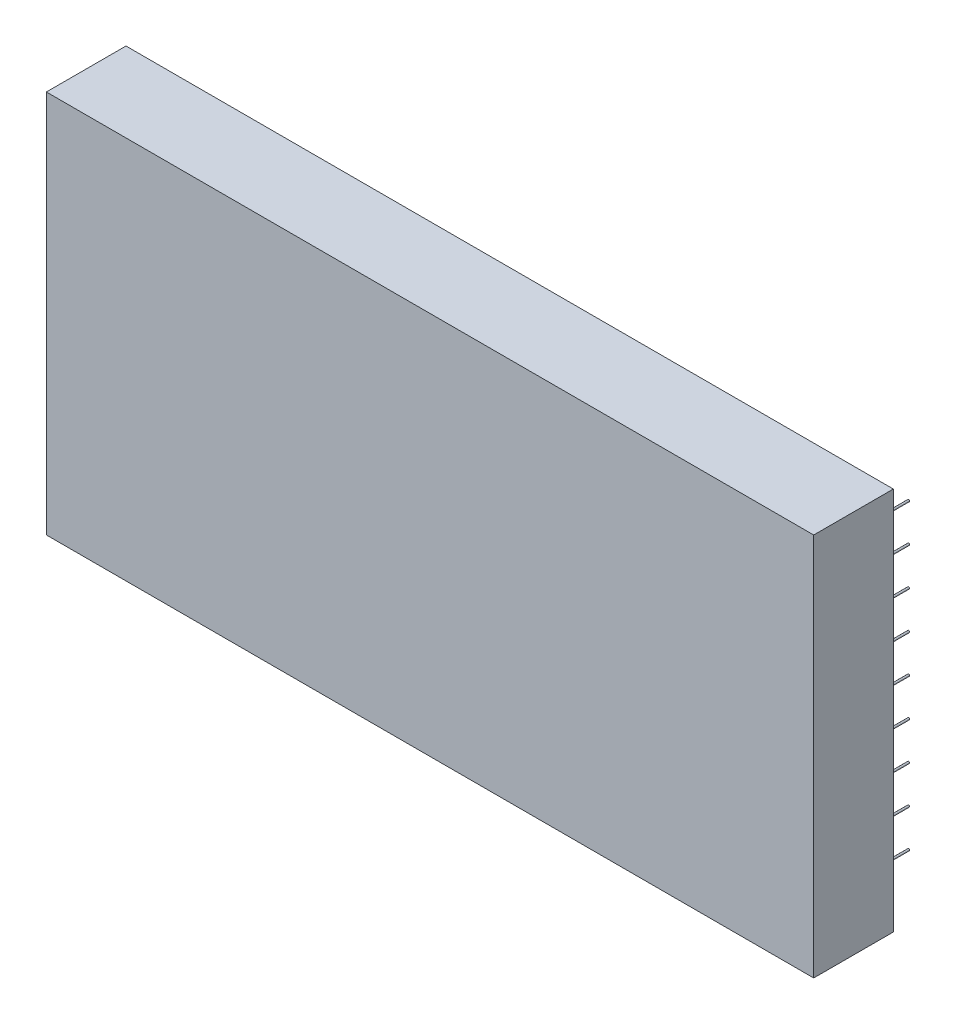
SolidWorks part; units mm, degrees
ref_plane "前视基准面" through (0, 0, 0) normal (0, 0, 1) x (1, 0, 0)
ref_plane "上视基准面" through (0, 0, 0) normal (0, 1, 0) x (1, 0, 0)
ref_plane "右视基准面" through (0, 0, 0) normal (1, 0, 0) x (0, 0, -1)
sketch "草图1" plane through (0, 0, 0) normal (0, 0, 1) x (1, 0, 0)
  line L1 (-2000, 1000) -> (2000, 1000)
  line L2 (-2000, 1000) -> (-2000, -1000)
  line L3 (-2000, -1000) -> (2000, -1000)
  line L4 (2000, 1000) -> (2000, -1000)
  line L5 (-2000, 1000) -> (2000, -1000) construction
  line L6 (-2000, -1000) -> (2000, 1000) construction
  point P0 (0, 0)
  dimension "D1" = 2000
  dimension "D2" = 4000
extrude "凸台-拉伸1" add sketch "草图1" along normal blind 415
sketch "草图2" plane through (0, -1000, 0) normal (0, 1, 0) x (1, 0, 0)
  line L0 (2000, 0) -> (-570, 0) construction
  line L1 (2000, 0) -> (-2000, 0) construction
  line L2 (-570, 0) -> (-570, -400) construction
  line L4 (-570, -400) -> (-370, -400)
  line L5 (-370, -400) -> (-370, -250)
  line L6 (-370, -250) -> (-270, -250)
  line L7 (-270, -250) -> (-270, 0)
  line L8 (-270, 0) -> (-970, 0)
  line L9 (-970, 0) -> (-970, -100)
  line L10 (-970, -100) -> (-870, -100)
  line L11 (-870, -100) -> (-870, -200)
  line L12 (-870, -200) -> (-770, -200)
  line L13 (-770, -200) -> (-770, -300)
  line L14 (-770, -300) -> (-670, -300)
  line L15 (-670, -300) -> (-670, -400)
  line L16 (-670, -400) -> (-570, -400)
  dimension "D1" = 2570
  dimension "D2" = 400
  dimension "D3" = 100
  dimension "D4" = 100
  dimension "D5" = 100
  dimension "D6" = 100
  dimension "D7" = 100
  dimension "D8" = 100
  dimension "D9" = 600
  dimension "D10" = 300
  dimension "D11" = 150
  dimension "D12" = 100
extrude "切除-拉伸1" cut sketch "草图2" along normal blind 515
sketch "草图4" plane through (0, 0, 0) normal (0, 0, -1) x (-1, 0, 0)
  line L0 (270, -485) -> (970, -485) construction
  line L1 (270, 835) -> (870, 835)
  line L2 (270, 835) -> (270, -485)
  line L3 (270, -485) -> (870, -485)
  line L4 (870, 835) -> (870, -485)
  line L5 (270, 835) -> (870, -485) construction
  line L6 (270, -485) -> (870, 835) construction
  line L7 (270, -485) -> (970, -485) construction
  line L8 (-2000, -1000) -> (-2000, 1000) construction
  line L9 (-2000, 1000) -> (2000, 1000) construction
  point P0 (570, 175)
  dimension "D1" = 2570
  dimension "D2" = 600
  dimension "D3" = 165
extrude "切除-拉伸2" cut sketch "草图4" against normal blind 400
sketch "草图5" plane through (0, -1000, 0) normal (0, -1, 0) x (1, 0, 0)
  line L0 (-270, 0) -> (-270, 415)
  line L1 (-2000, 415) -> (2000, 415) construction
  line L2 (-970, 0) -> (-970, 415)
  line L3 (-970, 415) -> (-270, 415)
  line L4 (-270, 0) -> (-970, 0)
extrude "凸台-拉伸3" add sketch "草图5" against normal blind 15
sketch "草图6" plane through (0, 0, 0) normal (0, 0, -1) x (-1, 0, 0)
  line L0 (-1880, -1000) -> (-1880, -985) construction
  line L1 (2000, -1000) -> (-2000, -1000) construction
  line L2 (-1880, -985) -> (-1880, -788) construction
  line L3 (-1880, -591) -> (-1880, -394) construction
  line L4 (-1880, -394) -> (-1880, -197) construction
  line L5 (-1880, -197) -> (-1880, 0) construction
  line L6 (-1880, 0) -> (-1880, 197) construction
  line L7 (-1880, 197) -> (-1880, 394) construction
  line L8 (-1880, 394) -> (-1880, 591) construction
  line L9 (-1880, 591) -> (-1880, 788) construction
  line L10 (-1880, 788) -> (-1880, 985) construction
  line L11 (-1880, 985) -> (-1880, 1000) construction
  line L12 (-2000, 1000) -> (2000, 1000) construction
  line L13 (-1880, -788) -> (-1880, -591) construction
  line L14 (-2000, -1000) -> (-2000, 1000) construction
  circle A0 centre (-1880, -788) radius 5
  circle A1 centre (-1880, -591) radius 5
  circle A2 centre (-1880, -394) radius 5
  circle A3 centre (-1880, -197) radius 5
  circle A4 centre (-1880, 0) radius 5
  circle A5 centre (-1880, 197) radius 5
  circle A6 centre (-1880, 394) radius 5
  circle A7 centre (-1880, 591) radius 5
  circle A8 centre (-1880, 788) radius 5
  dimension "D4" = 10
  dimension "D5" = 10
  dimension "D6" = 10
  dimension "D7" = 10
  dimension "D8" = 10
  dimension "D9" = 10
  dimension "D10" = 10
  dimension "D11" = 10
  dimension "D12" = 10
  dimension "D1" = 15
  dimension "D2" = 15
  dimension "D3" = 120
extrude "凸台-拉伸4" add sketch "草图6" along normal blind 200
sketch "草图8" plane through (0, 0, 0) normal (0, 0, -1) x (-1, 0, 0)
  line L0 (0, 0) -> (-60, 0) construction
  line L1 (-60, 0) -> (-360, 0) construction
  line L2 (-360, 0) -> (-660, 0) construction
  line L3 (-660, 0) -> (-1160, 0) construction
  circle A0 centre (-1880, 0) radius 5 construction
  circle A1 centre (-60, 0) radius 22.5
  dimension "D5" = 45
  dimension "D1" = 720
  dimension "D2" = 500
  dimension "D3" = 300
  dimension "D4" = 300
extrude "凸台-拉伸5" add sketch "草图8" along normal blind 25
sketch "草图10" plane through (0, 0, 0) normal (0, 0, -1) x (-1, 0, 0)
  circle A0 centre (-360, 0) radius 17.5
  dimension "D1" = 35
extrude "凸台-拉伸6" add sketch "草图10" along normal blind 20
sketch "草图11" plane through (0, 0, 0) normal (0, 0, -1) x (-1, 0, 0)
  circle A0 centre (-660, 0) radius 12.5
  dimension "D1" = 25
extrude "凸台-拉伸7" add sketch "草图11" along normal blind 14
sketch "草图12" plane through (0, 0, 0) normal (0, 0, -1) x (-1, 0, 0)
  line L1 (-1140, -20) -> (-1180, -20)
  line L2 (-1140, -20) -> (-1140, 20)
  line L3 (-1140, 20) -> (-1180, 20)
  line L4 (-1180, -20) -> (-1180, 20)
  line L5 (-1140, -20) -> (-1180, 20) construction
  line L6 (-1140, 20) -> (-1180, -20) construction
  point P0 (-1160, 0)
  dimension "D1" = 40
  dimension "D2" = 40
extrude "凸台-拉伸8" add sketch "草图12" along normal blind 400
sketch "草图13" plane through (0, 0, -25) normal (0, 0, -1) x (-1, 0, 0)
  circle A0 centre (-60, 0) radius 15
  dimension "D1" = 30
extrude "凸台-拉伸9" add sketch "草图13" along normal blind 35
sketch "草图14" plane through (0, 0, -20) normal (0, 0, -1) x (-1, 0, 0)
  circle A0 centre (-360, 0) radius 12
  dimension "D1" = 24
extrude "凸台-拉伸10" add sketch "草图14" along normal blind 40
sketch "草图15" plane through (0, 0, -14) normal (0, 0, -1) x (-1, 0, 0)
  circle A0 centre (-660, 0) radius 8
  dimension "D1" = 16
extrude "凸台-拉伸11" add sketch "草图15" along normal blind 46
chamfer "倒角1" distance 1 angle 45 3 edges at (652, 0, -60) (348, 0, -60) (45, 0, -60)
sketch "草图16" plane through (0, 0, -400) normal (0, 0, -1) x (-1, 0, 0)
  line L0 (-1160, 20) -> (-1160, -20) construction
  line L1 (-1140, 20) -> (-1180, 20) construction
  line L2 (-1180, -20) -> (-1140, -20) construction
  line L4 (-960, -20) -> (-1360, -20)
  line L5 (-960, -20) -> (-960, 20)
  line L6 (-960, 20) -> (-1360, 20)
  line L7 (-1360, -20) -> (-1360, 20)
  line L8 (-960, -20) -> (-1360, 20) construction
  line L9 (-960, 20) -> (-1360, -20) construction
  point P6 (-1160, 0)
  dimension "D1" = 40
  dimension "D2" = 400
extrude "凸台-拉伸12" add sketch "草图16" along normal blind 40
sketch "草图17" plane through (0, 0, 0) normal (0, 0, -1) x (-1, 0, 0)
  line L0 (2000, 0) -> (1985, 0) construction
  line L1 (2000, 1000) -> (2000, -1000) construction
  line L2 (1985, 165) -> (1985, -165)
  line L3 (1985, -165) -> (1670, -165)
  line L4 (1670, -165) -> (1670, -150)
  line L5 (1670, -150) -> (1970, -150)
  line L6 (1970, -150) -> (1970, 150)
  line L7 (1970, 0) -> (1985, 0) construction
  line L8 (1670, 150) -> (1970, 150)
  line L9 (1670, 165) -> (1670, 150)
  line L10 (1985, 165) -> (1670, 165)
  dimension "D1" = 15
  dimension "D2" = 15
  dimension "D3" = 15
  dimension "D4" = 300
  dimension "D5" = 300
extrude "凸台-拉伸13" add sketch "草图17" along normal blind 300
sketch "草图18" plane through (1360, 0, 0) normal (1, 0, 0) x (0, 0, -1)
  line L0 (440, 0) -> (470, 0) construction
  line L1 (440, 20) -> (440, -20) construction
  line L2 (464.4098, -5) -> (440, -5)
  line L3 (440, -5) -> (440, 5)
  line L4 (440, 5) -> (464.4098, 5)
  arc A0 (464.4098, -5) -> (464.4098, 5) centre (470, 0) ccw
  circle A1 centre (470, 0) radius 4
  dimension "D2" = 15
  dimension "D5" = 8
  dimension "D1" = 30
  dimension "D3" = 5
  dimension "D4" = 5
extrude "凸台-拉伸14" add sketch "草图18" against normal blind 5 from offset 60
pattern_linear "阵列(线性)1" count 2 spacing 35 along (-1, 0, 0) of "凸台-拉伸14"
sketch "草图19" plane through (0, 0, -440) normal (0, 0, -1) x (-1, 0, 0)
  line L0 (-1265, 0) -> (-1295, 0) construction
  line L1 (-1265, 5) -> (-1265, -5) construction
  line L2 (-1295, 5) -> (-1295, -5) construction
  circle A0 centre (-1280, 0) radius 12.5
  dimension "D1" = 25
extrude "切除-拉伸3" cut sketch "草图19" against normal blind 62
sketch "草图20" plane through (1265, 0, 0) normal (1, 0, 0) x (0, 0, -1)
  circle A0 centre (470, 0) radius 7.5
  circle A1 centre (470, 0) radius 4
  dimension "D1" = 8
  dimension "D2" = 15
extrude "凸台-拉伸15" add sketch "草图20" along normal blind 13
pattern_linear "阵列(线性)2" count 2 spacing 120 along (-1, 0, 0) of "凸台-拉伸14"
sketch "草图22" plane through (0, 0, -440) normal (0, 0, -1) x (-1, 0, 0)
  line L0 (-1295, 5) -> (-1300, 5) construction
  line L1 (-1286.4864, -27.0177) -> (-1308.5136, -27.0177)
  line L2 (-1286.4864, -27.0177) -> (-1286.4864, 37.0177)
  line L3 (-1286.4864, 37.0177) -> (-1308.5136, 37.0177)
  line L4 (-1308.5136, -27.0177) -> (-1308.5136, 37.0177)
  line L5 (-1286.4864, -27.0177) -> (-1308.5136, 37.0177) construction
  line L6 (-1286.4864, 37.0177) -> (-1308.5136, -27.0177) construction
  point P0 (-1297.5, 5)
extrude "切除-拉伸4" cut sketch "草图22" along normal blind 70
sketch "草图23" plane through (0, 0, -440) normal (0, 0, -1) x (-1, 0, 0)
  line L0 (-960, -20) -> (-960, 20) construction
  line L1 (-995, -15) -> (-980, -15)
  line L2 (-995, -15) -> (-995, -10)
  line L3 (-995, -10) -> (-980, -10)
  line L4 (-980, -15) -> (-980, -10)
  line L5 (-995, -15) -> (-980, -10) construction
  line L6 (-995, -10) -> (-980, -15) construction
  line L7 (-1360, -20) -> (-960, -20) construction
  point P0 (-987.5, -12.5)
  dimension "D1" = 20
  dimension "D2" = 5
  dimension "D3" = 15
  dimension "D4" = 5
extrude "凸台-拉伸17" add sketch "草图23" along normal blind 40
sketch "草图24" plane through (0, -10, 0) normal (0, 1, 0) x (1, 0, 0)
  line L0 (987.5, 480) -> (987.5, 472) construction
  line L1 (980, 480) -> (995, 480) construction
  circle A0 centre (987.5, 472) radius 3
  dimension "D2" = 6
  dimension "D1" = 8
extrude "凸台-拉伸18" add sketch "草图24" along normal blind 20
sketch "草图25" plane through (1360, 0, 0) normal (1, 0, 0) x (0, 0, -1)
  line L0 (400, 0) -> (330, 0) construction
  line L1 (400, 20) -> (400, -20) construction
  line L2 (400, 3) -> (332.6458, 3)
  line L3 (400, -3) -> (332.6458, -3)
  line L4 (400, 3) -> (400, -3)
  line L5 (400, 3) -> (330, 3) construction
  line L6 (400, -3) -> (330, -3) construction
  line L7 (400, -3) -> (400.9671, -4.0642)
  arc A0 (332.6458, 3) -> (332.6458, -3) centre (330, 0) ccw
  circle A1 centre (330, 0) radius 2.5
  dimension "D2" = 8
  dimension "D5" = 5
  dimension "D1" = 70
  dimension "D3" = 3
  dimension "D4" = 3
extrude "凸台-拉伸19" add sketch "草图25" against normal blind 5 from offset 5
pattern_linear "阵列(线性)3" count 2 spacing 145 along (-1, 0, 0) of "凸台-拉伸19"
sketch "草图26" plane through (0, 0, -440) normal (0, 0, -1) x (-1, 0, 0)
  line L0 (-960, 0) -> (-987.5, 0) construction
  line L1 (-960, -20) -> (-960, 20) construction
  circle A0 centre (-987.5, 0) radius 2.5
  dimension "D1" = 5
  dimension "D2" = 27.5
extrude "切除-拉伸5" cut sketch "草图26" against normal blind 59
